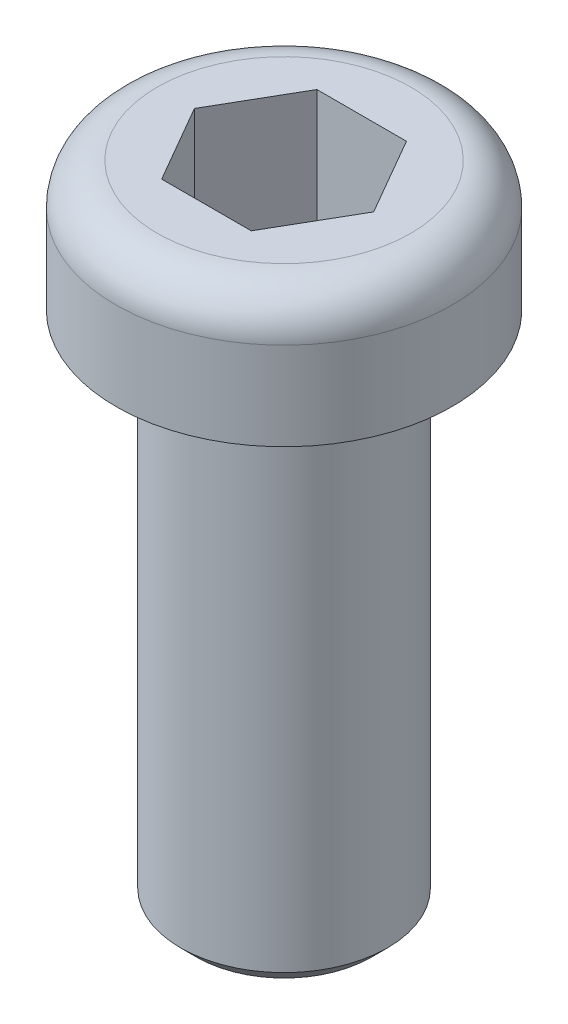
SolidWorks part; units mm, degrees
ref_plane "Plan1" through (0, 0, 0) normal (0, 0, 1) x (1, 0, 0)
ref_plane "Plan2" through (0, 0, 0) normal (0, 1, 0) x (1, 0, 0)
ref_plane "Plan3" through (0, 0, 0) normal (1, 0, 0) x (0, 0, -1)
sketch "Esquisse1" plane through (0, 0, 0) normal (0, 0, 1) x (1, 0, 0)
  line L0 (0, 5) -> (0, -20) construction
  line L1 (0, 5) -> (4.9, 5)
  line L2 (6.5, 3.4) -> (6.5, 0)
  line L3 (6.5, 0) -> (4.4, 0)
  line L4 (4, -0.4) -> (4, -19.375)
  line L5 (3.375, -20) -> (0, -20)
  line L6 (4, -19.375) -> (3.375, -20)
  line L7 (0, -20) -> (0, 5)
  arc A0 (4.9, 5) -> (6.5, 3.4) centre (4.9, 3.4) cw
  arc A1 (4.4, 0) -> (4, -0.4) centre (4.4, -0.4) ccw
  point P12 (4, -20)
  dimension "C2" = 0.4
  dimension "C1" = 1.6
  dimension "D1" = 13
  dimension "R" = 0.625
  dimension "D2" = 45
  dimension "L1" = 20
  dimension "H" = 5
  dimension "D" = 8
revolve "Révolution1" add sketch "Esquisse1" angle 360 about L0
sketch "Esquisse2" plane through (0, 5, 0) normal (0, 1, 0) x (1, 0, 0)
  line L1 (3.4641, 0) -> (1.7321, 3)
  line L2 (1.7321, 3) -> (-1.7321, 3)
  line L3 (-1.7321, 3) -> (-3.4641, 0)
  line L4 (-3.4641, 0) -> (-1.7321, -3)
  line L5 (-1.7321, -3) -> (1.7321, -3)
  line L6 (1.7321, -3) -> (3.4641, 0)
  circle A0 centre (0, 0) radius 3 construction
  dimension "S" = 6
extrude "Enlèv. mat.-Extru.1" cut sketch "Esquisse2" against normal blind 5
equation "\"C1@Esquisse1\" = \"D@Esquisse1\"/5"
equation "\"Prof@Enlèv. mat.-Extru.1\" = \"D@Esquisse1\"*0.625"
equation "\"C2@Esquisse1\"=\"D@Esquisse1\"/20"
equation "\"R@Esquisse1\"=(\"D@Esquisse1\"-\"D2@Représentation de filetage1\")/2"
